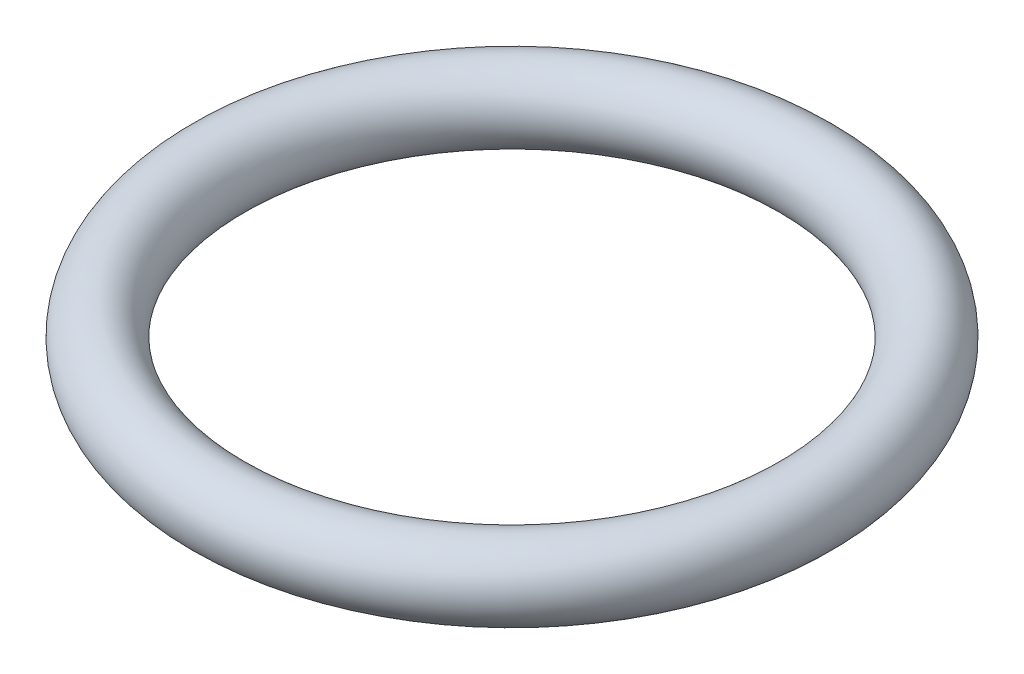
SolidWorks part; units mm, degrees
ref_plane "Plan de face" through (0, 0, 0) normal (0, 0, 1) x (1, 0, 0)
ref_plane "Plan de dessus" through (0, 0, 0) normal (0, 1, 0) x (1, 0, 0)
ref_plane "Plan de droite" through (0, 0, 0) normal (1, 0, 0) x (0, 0, -1)
sketch "Esquisse1" plane through (0, 0, 0) normal (1, 0, 0) x (0, 0, -1)
  line L0 (0, -35.0108) -> (0, 57.622) construction
  line L1 (52.5162, 0) -> (-70.9941, 0) construction
  line L2 (-21.12, -35.0108) -> (-21.12, 57.622) construction
  circle A0 centre (-21.12, 0) radius 2.62
  dimension "D1" = 21.12
revolve "Révolution1" add sketch "Esquisse1" angle 360 about L0
